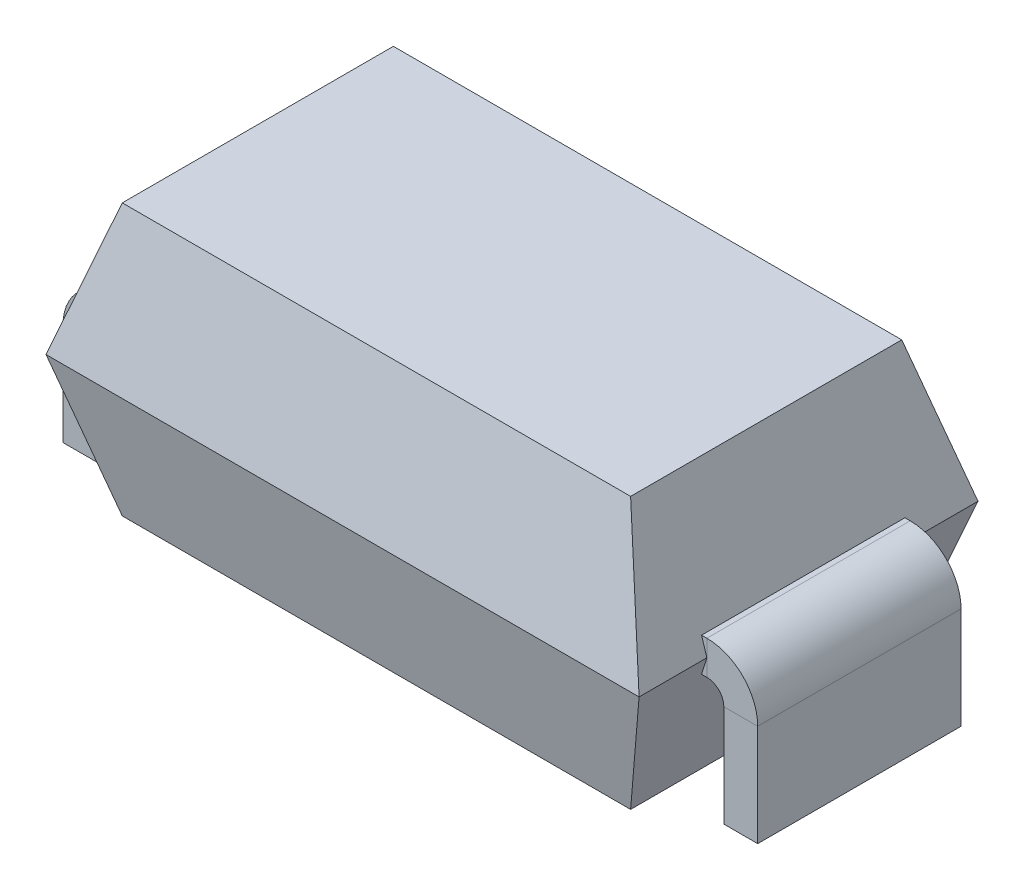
SolidWorks part; units mm, degrees
ref_plane "Front Plane" through (0, 0, 0) normal (0, 0, 1) x (1, 0, 0)
ref_plane "Top Plane" through (0, 0, 0) normal (0, 1, 0) x (1, 0, 0)
ref_plane "Right Plane" through (0, 0, 0) normal (1, 0, 0) x (0, 0, -1)
sketch "Base" plane through (0, 0, 0) normal (0, 1, 0) x (1, 0, 0)
  line L1 (-1.75, 1) -> (1.75, 1)
  line L2 (-1.75, 1) -> (-1.75, -1)
  line L3 (-1.75, -1) -> (1.75, -1)
  line L4 (1.75, 1) -> (1.75, -1)
  line L5 (-1.75, 1) -> (1.75, -1) construction
  line L6 (-1.75, -1) -> (1.75, 1) construction
  point P0 (0, 0)
  dimension "D1" = 2
  dimension "D2" = 3.5
ref_plane "TopRP" through (0, 0.8, 0) normal (0, 1, 0) x (1, 0, 0)
sketch "Top" plane through (0, 0.8, 0) normal (0, 1, 0) x (1, 0, 0)
  line L0 (-1.75, 1) -> (-1.75, -1) construction
  line L1 (-1.5, 0.8) -> (1.5, 0.8)
  line L2 (-1.5, 0.8) -> (-1.5, -0.8)
  line L3 (-1.5, -0.8) -> (1.5, -0.8)
  line L4 (1.5, 0.8) -> (1.5, -0.8)
  line L5 (-1.5, 0.8) -> (1.5, -0.8) construction
  line L6 (-1.5, -0.8) -> (1.5, 0.8) construction
  line L7 (-1.75, 1) -> (1.75, 1) construction
  point P0 (0, 0)
  dimension "D1" = 0.25
  dimension "D2" = 0.2
loft "Loft1" add profiles "Base", "Top"
mirror "Mirror1" about plane through (0, 0, 0) normal (0, 1, 0) of "Loft1"
sketch "RefP" plane through (0, 0, 0) normal (0, 0, 1) x (1, 0, 0)
  line L0 (-1.75, 0) -> (1.75, 0) construction
  point P0 (1.55, 0)
  point P1 (1.4842, 0)
  dimension "D1" = 0.2
ref_plane "LegP" through (1.55, 0, 0) normal (1, 0, 0) x (0, 0, -1)
sketch "Sketch3" plane through (0, 0, 0) normal (0, 0, 1) x (1, 0, 0)
  line L0 (1.55, 0) -> (1.75, 0)
  line L1 (1.95, -0.2) -> (1.95, -0.8)
  line L2 (1.95, -0.8) -> (1.5, -0.8) construction
  arc A0 (1.75, 0) -> (1.95, -0.2) centre (1.75, -0.2) cw
  point P7 (1.8379, 0)
  point P10 (1.75, 0)
  dimension "D1" = 0.2
sketch "Sketch4" plane through (1.55, 0, 0) normal (1, 0, 0) x (0, 0, -1)
  line L1 (0.6, 0.1) -> (-0.6, 0.1)
  line L2 (0.6, 0.1) -> (0.6, -0.1)
  line L3 (0.6, -0.1) -> (-0.6, -0.1)
  line L4 (-0.6, 0.1) -> (-0.6, -0.1)
  line L5 (0.6, 0.1) -> (-0.6, -0.1) construction
  line L6 (0.6, -0.1) -> (-0.6, 0.1) construction
  point P0 (0, 0)
  dimension "Height" = 0.2
  dimension "Width" = 1.2
sweep "Sweep1" add profiles "Sketch4" path "Sketch3"
mirror "Mirror3" about plane through (0, 0, 0) normal (1, 0, 0) of "Sweep1"
